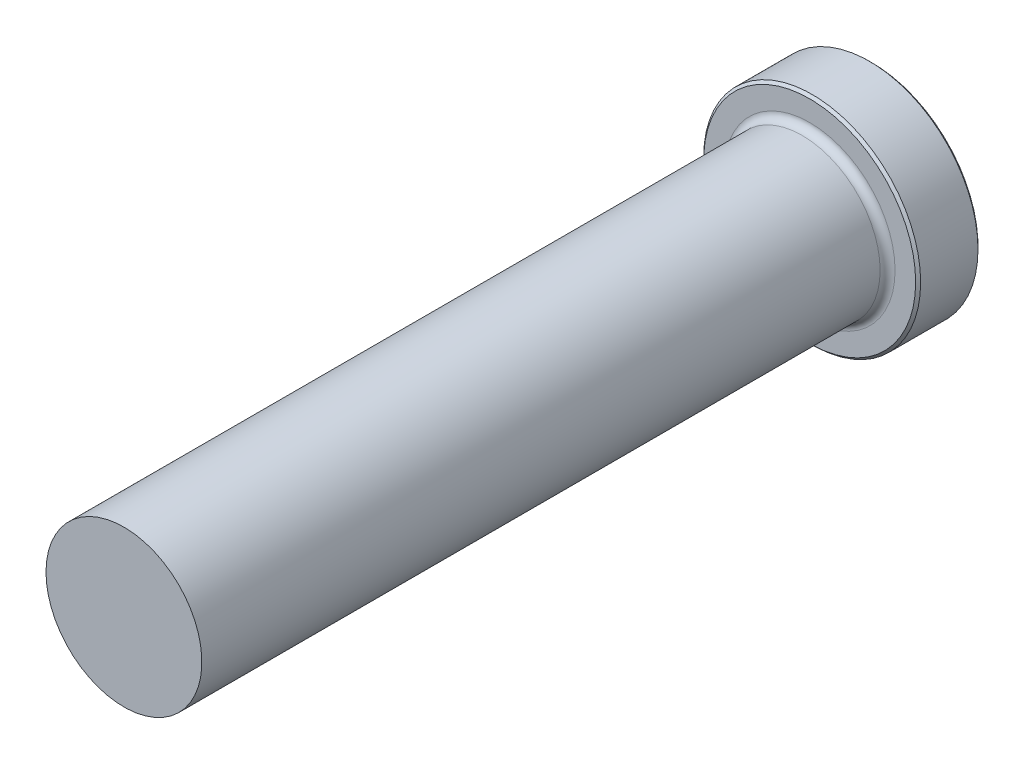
SolidWorks part; units mm, degrees
ref_plane "Front Plane" through (0, 0, 0) normal (0, 0, 1) x (1, 0, 0)
ref_plane "Top Plane" through (0, 0, 0) normal (0, 1, 0) x (1, 0, 0)
ref_plane "Right Plane" through (0, 0, 0) normal (1, 0, 0) x (0, 0, -1)
sketch "Sketch1" plane through (0, 0, 0) normal (1, 0, 0) x (0, 0, -1)
  line L0 (0, 0) -> (-156.8087, 0) construction
  line L1 (0, 0) -> (0, 11.049)
  line L2 (0, 11.049) -> (-6.35, 11.049)
  line L3 (-6.35, 11.049) -> (-6.35, 7.9375)
  line L4 (-6.35, 7.9375) -> (-76.2, 7.9375)
  line L5 (-76.2, 7.9375) -> (-76.2, 0)
  line L6 (-76.2, 0) -> (0, 0)
  dimension "D1" = 22.098
  dimension "D2" = 15.875
  dimension "D3" = 6.35
  dimension "D4" = 76.2
revolve "Revolve1" add sketch "Sketch1" angle 360 about L0
fillet "Fillet1" radius 0.762 1 edges at (-7.9375, 0, 6.35)
chamfer "Chamfer1" distance 0.254 angle 45 2 edges at (-11.049, 0, 0) (-11.049, 0, 6.35)
